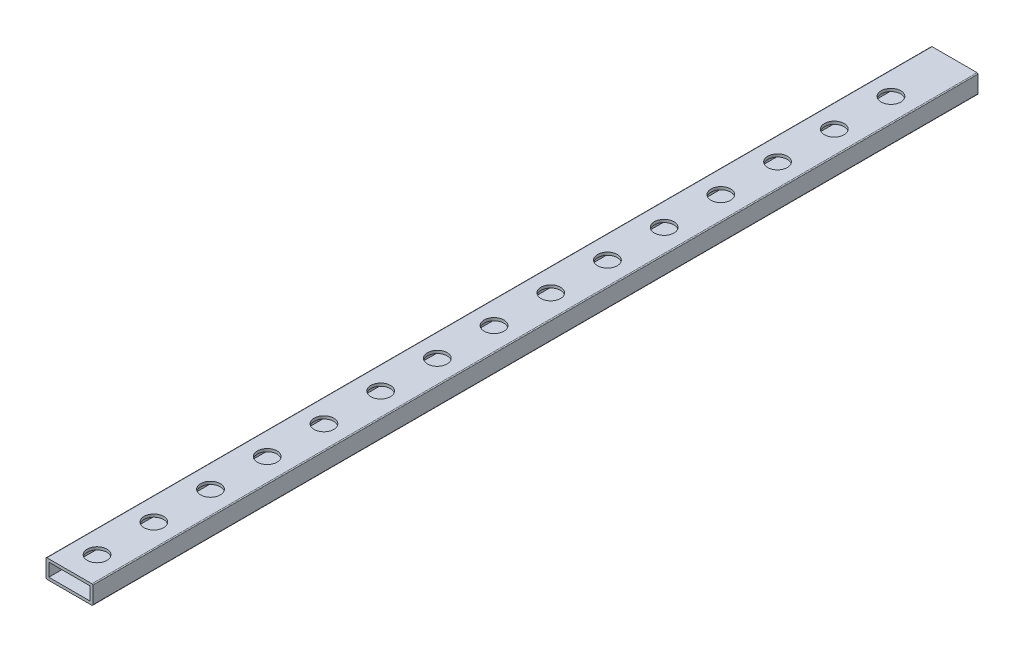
SolidWorks part; units mm, degrees
ref_plane "Plan de face" through (0, 0, 0) normal (0, 0, 1) x (1, 0, 0)
ref_plane "Plan de dessus" through (0, 0, 0) normal (0, 1, 0) x (1, 0, 0)
ref_plane "Plan de droite" through (0, 0, 0) normal (1, 0, 0) x (0, 0, -1)
sketch "Esquisse1" plane through (0, 0, 0) normal (0, 0, 1) x (1, 0, 0)
  line L0 (-11, 3.5) -> (11, 3.5)
  line L1 (-15.5633, 0) -> (15.5633, 0) construction
  line L2 (11, 3.5) -> (11, -3.5)
  line L3 (-12, 5) -> (12, 5)
  line L4 (-12.5, 4.5) -> (-12.5, -4.5)
  line L5 (-12, -5) -> (12, -5)
  line L6 (12.5, 4.5) -> (12.5, -4.5)
  line L7 (-11, -3.5) -> (11, -3.5)
  line L8 (-11, 3.5) -> (-11, -3.5)
  arc A0 (12, 5) -> (12.5, 4.5) centre (12, 4.5) cw
  arc A1 (12, -5) -> (12.5, -4.5) centre (12, -4.5) ccw
  arc A2 (-12.5, -4.5) -> (-12, -5) centre (-12, -4.5) ccw
  arc A3 (-12, 5) -> (-12.5, 4.5) centre (-12, 4.5) ccw
  arc A4 (11, 3.5) -> (11, 3.5) centre (11, 3.5) cw
  arc A5 (11, -3.5) -> (11, -3.5) centre (11, -3.5) ccw
  arc A6 (-11, -3.5) -> (-11, -3.5) centre (-11, -3.5) ccw
  arc A7 (-11, 3.5) -> (-11, 3.5) centre (-11, 3.5) ccw
  dimension "D6" = 0.5
  dimension "D1" = 25
  dimension "D2" = 10
  dimension "D3" = 5
  dimension "D4" = 12.5
  dimension "D5" = 1.5
extrude "Boss.-Extru.1" add sketch "Esquisse1" along normal blind 473
sketch "Esquisse2" plane through (0, 5, 0) normal (0, 1, 0) x (1, 0, 0)
  line L0 (12, 0) -> (-12, 0) construction
  line L1 (12.5, -473) -> (12.5, 0) construction
  line L2 (0, 0) -> (0, -490.4814) construction
  circle A0 centre (0, -34) radius 5.25
  circle A1 centre (0, -64.3) radius 5.25
  circle A2 centre (0, -94.6) radius 5.25
  circle A3 centre (0, -124.9) radius 5.25
  circle A4 centre (0, -155.2) radius 5.25
  circle A5 centre (0, -185.5) radius 5.25
  circle A6 centre (0, -215.8) radius 5.25
  circle A7 centre (0, -246.1) radius 5.25
  circle A8 centre (0, -276.4) radius 5.25
  circle A9 centre (0, -306.7) radius 5.25
  circle A10 centre (0, -337) radius 5.25
  circle A11 centre (0, -367.3) radius 5.25
  circle A12 centre (0, -397.6) radius 5.25
  circle A13 centre (0, -427.9) radius 5.25
  circle A14 centre (0, -458.2) radius 5.25
  dimension "D1" = 10.5
  dimension "D2" = 34
  dimension "D3" = 12.5
  dimension "D4" = 30.3
extrude "Enlèv. mat.-Extru.1" cut sketch "Esquisse2" against normal blind 473
